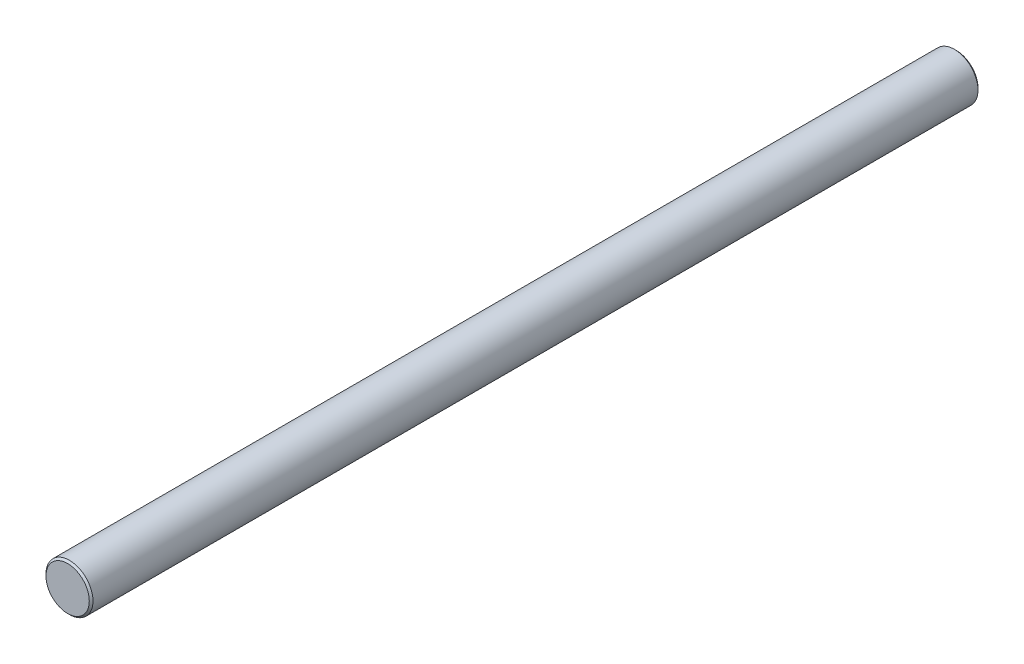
SolidWorks part; units mm, degrees
ref_plane "Front Plane" through (0, 0, 0) normal (0, 0, 1) x (1, 0, 0)
ref_plane "Top Plane" through (0, 0, 0) normal (0, 1, 0) x (1, 0, 0)
ref_plane "Right Plane" through (0, 0, 0) normal (1, 0, 0) x (0, 0, -1)
sketch "Sketch1" plane through (0, 0, 0) normal (0, 0, 1) x (1, 0, 0)
  circle A0 centre (0, 0) radius 6.35
  dimension "D1" = 12.7
extrude "Boss-Extrude1" add sketch "Sketch1" along normal blind 240
chamfer "Chamfer1" distance 0.5 angle 45 2 edges at (6.35, 0, 0) (6.35, 0, 240)
